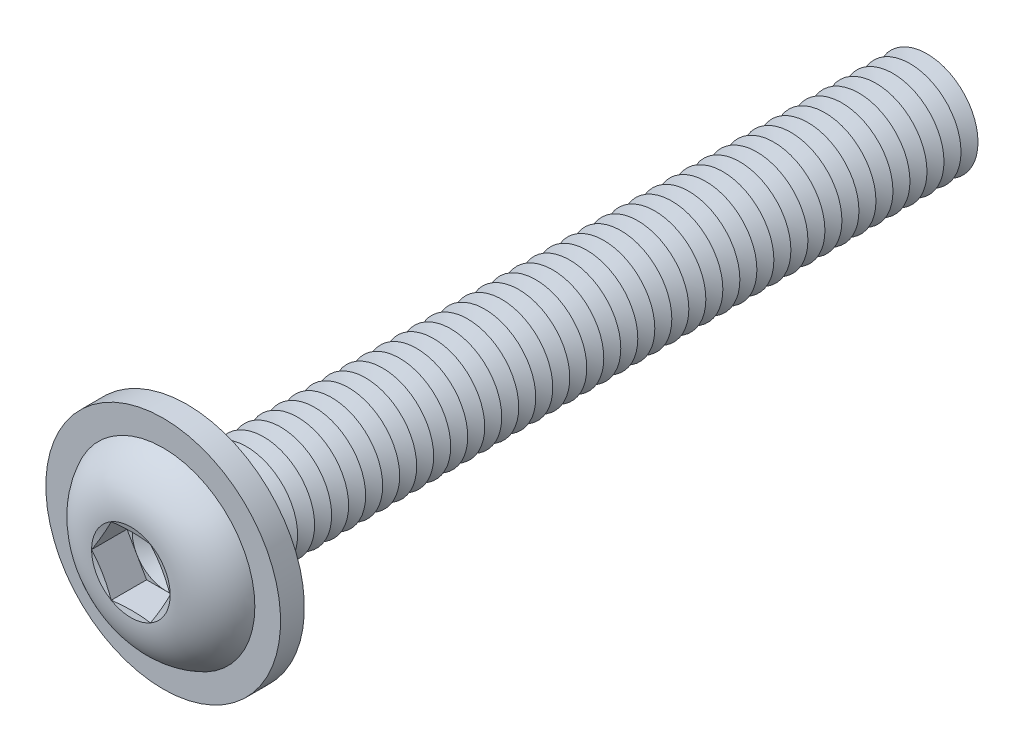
SolidWorks part; units mm, degrees
ref_plane "Front Plane" through (0, 0, 0) normal (0, 0, 1) x (1, 0, 0)
ref_plane "Top Plane" through (0, 0, 0) normal (0, 1, 0) x (1, 0, 0)
ref_plane "Right Plane" through (0, 0, 0) normal (1, 0, 0) x (0, 0, -1)
sketch "Sketch1" plane through (0, 0, 0) normal (1, 0, 0) x (0, 0, -1)
  line L0 (0, 1.5) -> (0, 2.85)
  line L3 (0, 1.5) -> (22, 1.5)
  line L4 (22, 1.5) -> (22, 0)
  line L5 (22, 0) -> (-1.65, 0) construction
  line L6 (-1.65, 0) -> (22, 0)
  line L7 (-1.65, 1.1547) -> (-1.65, 0.5773) construction
  line L8 (-1.65, 0.5773) -> (-1.65, 0)
  line L9 (-1.65, 1.1547) -> (-1.4953, 0.5773)
  line L10 (-1.4953, 0.5773) -> (-1.65, 0.5773)
  line L11 (22, 0) -> (22.7481, 0) construction
  line L12 (0, 2.85) -> (-1.65, 2.85) construction
  arc A1 (0, 2.85) -> (-1.65, 1.1547) centre (0, 1.1994) ccw
  point P8 (22, 0.75)
  dimension "D1" = 5.7
  dimension "D2" = 3
  dimension "D3" = 1.65
  dimension "D4" = 2.3094
  dimension "D5" = 22
  dimension "D6" = 15
revolve "Revolve1" add sketch "Sketch1" angle 360 about L5
fillet "Fillet1" radius 0.25 1 edges at (-1.5, 0, 0)
sketch "Sketch2" plane through (0, 0, 0) normal (1, 0, 0) x (0, 0, -1)
  line L0 (21.75, 1.5) -> (22.25, 1.5)
  line L1 (22, 1.5) -> (0.25, 1.5) construction
  line L2 (22.25, 1.5) -> (22, 1.067)
  line L3 (22, -1.5) -> (22, 1.5) construction
  line L4 (22, 1.067) -> (21.75, 1.5)
  dimension "D1" = 0.5
revolve "Cut-Revolve1" cut sketch "Sketch2" angle 360 about axis through (0, 0, -22) along (0, 0, -1)
pattern_linear "LPattern1" count 44 spacing 0.5 along (0, 0, 1) of "Cut-Revolve1"
sketch "Sketch3" plane through (0, 0, 1.65) normal (0, 0, 1) x (1, 0, 0)
  line L7 (0.5773, 1) -> (-0.5774, 1)
  line L8 (-0.5774, 1) -> (-1.1547, 0)
  line L9 (-1.1547, 0) -> (-0.5773, -1)
  line L10 (-0.5773, -1) -> (0.5773, -1)
  line L11 (0.5773, -1) -> (1.1547, 0)
  line L12 (1.1547, 0) -> (0.5773, 1)
  circle A0 centre (0, 0) radius 1 construction
  circle A3 centre (0, 0) radius 1.1547 construction
extrude "Cut-Extrude1" cut sketch "Sketch3" against normal blind 1.04
sketch "Sketch4" plane through (0, 0, 0.61) normal (0, 0, 1) x (1, 0, 0)
  line L1 (0.5773, 1) -> (-0.5774, 1) construction
  circle A0 centre (0, 0) radius 1
extrude "Cut-Extrude2" cut sketch "Sketch4" against normal through all draft 60
sketch "Sketch5" plane through (0, 0, 0) normal (0, 0, -1) x (-1, 0, 0)
  circle A0 centre (0, 0) radius 3.45
  circle A1 centre (0, 0) radius 1.75
  circle A2 centre (0, 0) radius 1.75 construction
  dimension "D1" = 6.9
extrude "Boss-Extrude1" add sketch "Sketch5" against normal blind 0.7
